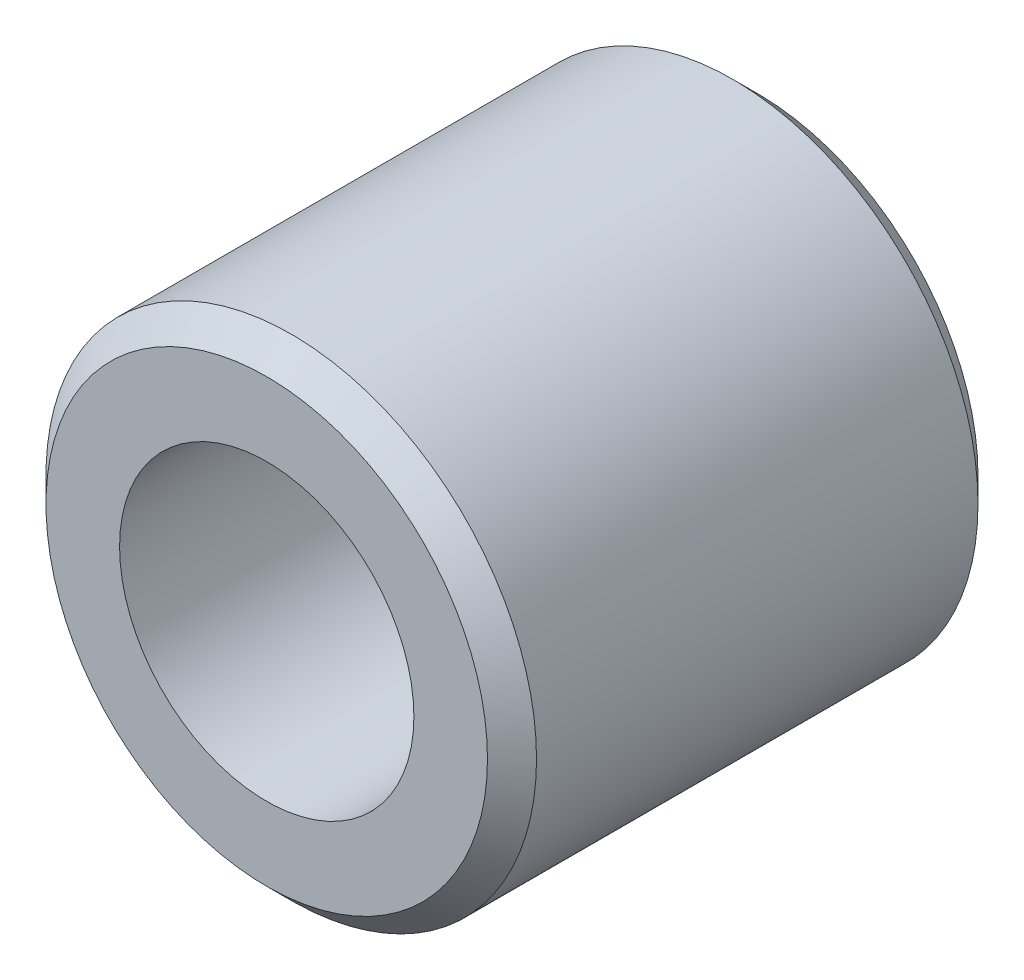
SolidWorks part; units mm, degrees
ref_plane "Plan de face" through (0, 0, 0) normal (0, 0, 1) x (1, 0, 0)
ref_plane "Plan de dessus" through (0, 0, 0) normal (0, 1, 0) x (1, 0, 0)
ref_plane "Plan de droite" through (0, 0, 0) normal (1, 0, 0) x (0, 0, -1)
sketch "Esquisse1" plane through (0, 0, 0) normal (0, 0, 1) x (1, 0, 0)
  circle A0 centre (0, 0) radius 5
  circle A1 centre (0, 0) radius 3
  dimension "D1" = 6
  dimension "D2" = 10
extrude "Extrusion1" add sketch "Esquisse1" along normal blind 10
chamfer "Chanfrein1" distance 0.5 angle 45 2 edges at (5, 0, 0) (5, 0, 10)
